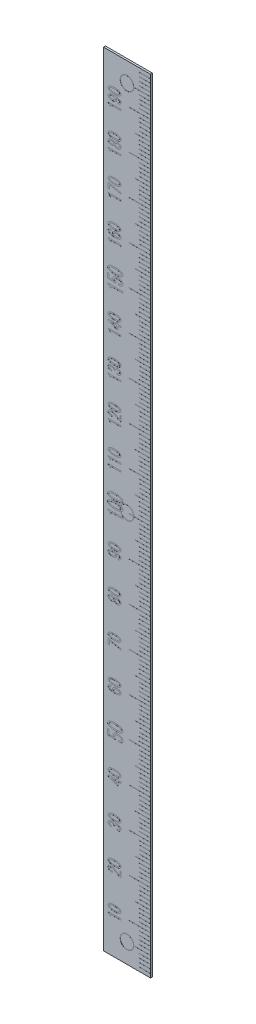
SolidWorks part; units mm, degrees
ref_plane "Front" through (0, 0, 0) normal (0, 0, 1) x (1, 0, 0)
ref_plane "Top" through (0, 0, 0) normal (0, 1, 0) x (1, 0, 0)
ref_plane "Right" through (0, 0, 0) normal (1, 0, 0) x (0, 0, -1)
sketch "Sketch1" plane through (0, 0, 0) normal (0, 0, 1) x (1, 0, 0)
  line L1 (0, 0) -> (0, 200)
  line L2 (0, 0) -> (12, 0)
  line L3 (12, 0) -> (12, 200)
  line L4 (0, 200) -> (12, 200)
  dimension "D1" = 200
  dimension "D2" = 12
extrude "Extrude1" add sketch "Sketch1" along normal blind 0.5
sketch "Sketch2" plane through (0, 0, 0.5) normal (0, 0, 1) x (1, 0, 0)
  line L0 (0, 200) -> (0, 0) construction
  line L1 (0, 0) -> (12, 0) construction
  line L2 (12, 200) -> (0, 200) construction
  circle A0 centre (6, 5) radius 1.75
  circle A1 centre (6, 195) radius 1.75
  circle A2 centre (6, 5) radius 1.65
  circle A3 centre (6, 195) radius 1.65
  circle A4 centre (6, 100) radius 1.75
  circle A5 centre (6, 100) radius 1.65
  dimension "D1" = 6
  dimension "D2" = 6
  dimension "D3" = 5
  dimension "D4" = 5
  dimension "D5" = 3.5
  dimension "D6" = 3.5
  dimension "D7" = 0.1
  dimension "D8" = 2
extrude "Extrude2" cut sketch "Sketch2" against normal blind 0.01
sketch "Sketch3" plane through (0, 0, 0.5) normal (0, 0, 1) x (1, 0, 0)
  line L0 (1, 187.4) -> (4.5, 187.4) construction
  line L1 (1, 137.4) -> (4.5, 137.4) construction
  line L2 (1, 137.4) -> (1, 140.9) construction
  line L3 (1, 140.9) -> (4.5, 140.9) construction
  line L4 (4.5, 137.4) -> (4.5, 140.9) construction
  line L5 (0, 200) -> (0, 0) construction
  line L6 (4.5, 127.4) -> (4.5, 130.9) construction
  line L7 (4.5, 117.4) -> (4.5, 120.9) construction
  line L8 (4.5, 107.4) -> (4.5, 110.9) construction
  line L9 (5, 97.2) -> (5, 102.8) construction
  line L10 (4.5, 88.25) -> (4.5, 91.75) construction
  line L11 (4.5, 78.25) -> (4.5, 81.75) construction
  line L12 (4.5, 68.25) -> (4.5, 71.75) construction
  line L13 (4.5, 58.25) -> (4.5, 61.75) construction
  line L14 (5, 48) -> (5, 52) construction
  line L15 (4.5, 38.25) -> (4.5, 43.5) construction
  line L16 (5, 110) -> (-4.9003, 110) construction
  line L17 (5, 50) -> (-4.9003, 50) construction
  line L18 (4.5, 28.25) -> (4.5, 33.5) construction
  line L19 (4.5, 18.25) -> (4.5, 23.5) construction
  line L20 (4.5, 8.25) -> (4.5, 13.5) construction
  line L21 (5, 100) -> (-4.9003, 100) construction
  line L22 (5, 120) -> (-4.9003, 120) construction
  line L23 (5, 130) -> (-4.9003, 130) construction
  line L24 (5, 140) -> (-4.9003, 140) construction
  line L25 (1, 187.4) -> (1, 190.9) construction
  line L26 (1, 190.9) -> (4.5, 190.9) construction
  line L27 (4.5, 187.4) -> (4.5, 190.9) construction
  line L28 (4.5, 177.4) -> (4.5, 180.9) construction
  line L29 (4.5, 167.4) -> (4.5, 170.9) construction
  line L30 (4.5, 157.4) -> (4.5, 160.9) construction
  line L31 (5, 147.2) -> (5, 152.8) construction
  line L32 (4.5, 160) -> (-4.9003, 160) construction
  line L33 (4.5, 150) -> (-4.9003, 150) construction
  line L34 (4.5, 170) -> (-4.9003, 170) construction
  line L35 (4.5, 180) -> (-4.9003, 180) construction
  line L36 (4.5, 190) -> (-4.9003, 190) construction
  line L37 (5, 40) -> (-4.9003, 40) construction
  line L38 (5, 30) -> (-4.9003, 30) construction
  line L39 (5, 20) -> (-4.9003, 20) construction
  line L40 (5, 10) -> (-4.9003, 10) construction
  line L41 (12, 0) -> (12, 200) construction
  text T0 "140" font "ＭＳ ゴシック" height in points 11
  text T1 "130" font "ＭＳ ゴシック" height in points 11
  text T2 "120" font "ＭＳ ゴシック" height in points 11
  text T3 "110" font "ＭＳ ゴシック" height in points 11
  text T4 "100" font "ＭＳ ゴシック" height in points 13
  text T5 "90" font "ＭＳ ゴシック" height in points 11
  text T6 "80" font "ＭＳ ゴシック" height in points 11
  text T7 "70" font "ＭＳ ゴシック" height in points 11
  text T8 "60" font "ＭＳ ゴシック" height in points 11
  text T9 "50" font "ＭＳ ゴシック" height in points 13
  text T10 "40" font "ＭＳ ゴシック" height in points 11
  text T11 "30" font "ＭＳ ゴシック" height in points 11
  text T12 "20" font "ＭＳ ゴシック" height in points 11
  text T13 "10" font "ＭＳ ゴシック" height in points 11
  text T14 "150" font "ＭＳ ゴシック" height in points 13
  text T15 "160" font "ＭＳ ゴシック" height in points 11
  text T16 "170" font "ＭＳ ゴシック" height in points 11
  text T17 "180" font "ＭＳ ゴシック" height in points 11
  text T18 "190" font "ＭＳ ゴシック" height in points 11
  point P19 (5, 100)
  dimension "D1" = 3.5
  dimension "D2" = 2.6
  dimension "D3" = 1
  dimension "D4" = 3.5
  dimension "D8" = 4
  dimension "D9" = 50
  dimension "D10" = 2
  dimension "D11" = 5.6
  dimension "D12" = 2.6
  dimension "D5" = 3.5
  dimension "D13" = 2.6
  dimension "D14" = 2.6
  dimension "D15" = 7
  dimension "D16" = 1.75
  dimension "D17" = 1.75
  dimension "D18" = 1.75
  dimension "D19" = 1.75
  dimension "D20" = 7
  dimension "D21" = 7
  dimension "D6" = 5
  dimension "D7" = 5
extrude "Extrude3" cut sketch "Sketch3" against normal blind 0.01
sketch "Sketch4" plane through (0, 0, 0.5) normal (0, 0, 1) x (1, 0, 0)
  line L0 (12, 190.05) -> (6.5, 190.05)
  line L1 (12, 0) -> (12, 200) construction
  line L2 (6.5, 190.05) -> (6.5, 189.95)
  line L3 (6.5, 189.95) -> (12, 189.95)
  line L4 (12, 189.95) -> (12, 190.05)
  line L5 (12, 200) -> (0, 200) construction
  line L6 (12, 198.05) -> (12, 197.95)
  line L7 (12, 194.95) -> (8, 194.95)
  line L8 (12, 194.95) -> (12, 195.05)
  line L9 (12, 195.05) -> (8, 195.05)
  line L10 (8, 194.95) -> (8, 195.05)
  line L11 (12, 199.05) -> (9, 199.05)
  line L12 (12, 199.05) -> (12, 198.95)
  line L13 (12, 198.95) -> (9, 198.95)
  line L14 (9, 199.05) -> (9, 198.95)
  line L15 (12, 198.05) -> (9, 198.05)
  line L16 (12, 197.95) -> (9, 197.95)
  line L17 (9, 198.05) -> (9, 197.95)
  line L18 (12, 197.05) -> (12, 196.95)
  line L19 (12, 197.05) -> (9, 197.05)
  line L20 (12, 196.95) -> (9, 196.95)
  line L21 (9, 197.05) -> (9, 196.95)
  line L22 (12, 196.05) -> (12, 195.95)
  line L23 (12, 196.05) -> (9, 196.05)
  line L24 (12, 195.95) -> (9, 195.95)
  line L25 (9, 196.05) -> (9, 195.95)
  line L26 (12, 180.05) -> (6.5, 180.05)
  line L27 (6.5, 180.05) -> (6.5, 179.95)
  line L28 (6.5, 179.95) -> (12, 179.95)
  line L29 (12, 179.95) -> (12, 180.05)
  line L30 (12, 194.05) -> (12, 193.95)
  line L31 (12, 194.05) -> (9, 194.05)
  line L32 (12, 193.95) -> (9, 193.95)
  line L33 (9, 194.05) -> (9, 193.95)
  line L34 (12, 193.05) -> (12, 192.95)
  line L35 (12, 193.05) -> (9, 193.05)
  line L36 (12, 192.95) -> (9, 192.95)
  line L37 (9, 193.05) -> (9, 192.95)
  line L38 (12, 192.05) -> (12, 191.95)
  line L39 (12, 192.05) -> (9, 192.05)
  line L40 (12, 191.95) -> (9, 191.95)
  line L41 (9, 192.05) -> (9, 191.95)
  line L42 (12, 191.05) -> (12, 190.95)
  line L43 (12, 191.05) -> (9, 191.05)
  line L44 (12, 190.95) -> (9, 190.95)
  line L45 (9, 191.05) -> (9, 190.95)
  line L46 (9, 195.05) -> (9, 194.95)
  line L47 (12, 195.05) -> (9, 195.05)
  line L48 (12, 194.95) -> (9, 194.95)
  line L49 (12, 195.05) -> (12, 194.95)
  line L50 (12, 188.05) -> (12, 187.95)
  line L51 (12, 184.95) -> (8, 184.95)
  line L52 (12, 184.95) -> (12, 185.05)
  line L53 (12, 185.05) -> (8, 185.05)
  line L54 (8, 184.95) -> (8, 185.05)
  line L55 (12, 189.05) -> (9, 189.05)
  line L56 (12, 189.05) -> (12, 188.95)
  line L57 (12, 188.95) -> (9, 188.95)
  line L58 (9, 189.05) -> (9, 188.95)
  line L59 (12, 188.05) -> (9, 188.05)
  line L60 (12, 187.95) -> (9, 187.95)
  line L61 (9, 188.05) -> (9, 187.95)
  line L62 (12, 187.05) -> (12, 186.95)
  line L63 (12, 187.05) -> (9, 187.05)
  line L64 (12, 186.95) -> (9, 186.95)
  line L65 (9, 187.05) -> (9, 186.95)
  line L66 (12, 186.05) -> (12, 185.95)
  line L67 (12, 186.05) -> (9, 186.05)
  line L68 (12, 185.95) -> (9, 185.95)
  line L69 (9, 186.05) -> (9, 185.95)
  line L70 (12, 184.05) -> (12, 183.95)
  line L71 (12, 184.05) -> (9, 184.05)
  line L72 (12, 183.95) -> (9, 183.95)
  line L73 (9, 184.05) -> (9, 183.95)
  line L74 (12, 183.05) -> (12, 182.95)
  line L75 (12, 183.05) -> (9, 183.05)
  line L76 (12, 182.95) -> (9, 182.95)
  line L77 (9, 183.05) -> (9, 182.95)
  line L78 (12, 182.05) -> (12, 181.95)
  line L79 (12, 182.05) -> (9, 182.05)
  line L80 (12, 181.95) -> (9, 181.95)
  line L81 (9, 182.05) -> (9, 181.95)
  line L82 (12, 181.05) -> (12, 180.95)
  line L83 (12, 181.05) -> (9, 181.05)
  line L84 (12, 180.95) -> (9, 180.95)
  line L85 (9, 181.05) -> (9, 180.95)
  line L86 (12, 170.05) -> (6.5, 170.05)
  line L87 (6.5, 170.05) -> (6.5, 169.95)
  line L88 (6.5, 169.95) -> (12, 169.95)
  line L89 (12, 169.95) -> (12, 170.05)
  line L90 (12, 178.05) -> (12, 177.95)
  line L91 (12, 174.95) -> (8, 174.95)
  line L92 (12, 174.95) -> (12, 175.05)
  line L93 (12, 175.05) -> (8, 175.05)
  line L94 (8, 174.95) -> (8, 175.05)
  line L95 (12, 179.05) -> (9, 179.05)
  line L96 (12, 179.05) -> (12, 178.95)
  line L97 (12, 178.95) -> (9, 178.95)
  line L98 (9, 179.05) -> (9, 178.95)
  line L99 (12, 178.05) -> (9, 178.05)
  line L100 (12, 177.95) -> (9, 177.95)
  line L101 (9, 178.05) -> (9, 177.95)
  line L102 (12, 177.05) -> (12, 176.95)
  line L103 (12, 177.05) -> (9, 177.05)
  line L104 (12, 176.95) -> (9, 176.95)
  line L105 (9, 177.05) -> (9, 176.95)
  line L106 (12, 176.05) -> (12, 175.95)
  line L107 (12, 176.05) -> (9, 176.05)
  line L108 (12, 175.95) -> (9, 175.95)
  line L109 (9, 176.05) -> (9, 175.95)
  line L110 (12, 174.05) -> (12, 173.95)
  line L111 (12, 174.05) -> (9, 174.05)
  line L112 (12, 173.95) -> (9, 173.95)
  line L113 (9, 174.05) -> (9, 173.95)
  line L114 (12, 173.05) -> (12, 172.95)
  line L115 (12, 173.05) -> (9, 173.05)
  line L116 (12, 172.95) -> (9, 172.95)
  line L117 (9, 173.05) -> (9, 172.95)
  line L118 (12, 172.05) -> (12, 171.95)
  line L119 (12, 172.05) -> (9, 172.05)
  line L120 (12, 171.95) -> (9, 171.95)
  line L121 (9, 172.05) -> (9, 171.95)
  line L122 (12, 171.05) -> (12, 170.95)
  line L123 (12, 171.05) -> (9, 171.05)
  line L124 (12, 170.95) -> (9, 170.95)
  line L125 (9, 171.05) -> (9, 170.95)
  line L126 (12, 160.05) -> (6.5, 160.05)
  line L127 (6.5, 160.05) -> (6.5, 159.95)
  line L128 (6.5, 159.95) -> (12, 159.95)
  line L129 (12, 159.95) -> (12, 160.05)
  line L130 (12, 168.05) -> (12, 167.95)
  line L131 (12, 164.95) -> (8, 164.95)
  line L132 (12, 164.95) -> (12, 165.05)
  line L133 (12, 165.05) -> (8, 165.05)
  line L134 (8, 164.95) -> (8, 165.05)
  line L135 (12, 169.05) -> (9, 169.05)
  line L136 (12, 169.05) -> (12, 168.95)
  line L137 (12, 168.95) -> (9, 168.95)
  line L138 (9, 169.05) -> (9, 168.95)
  line L139 (12, 168.05) -> (9, 168.05)
  line L140 (12, 167.95) -> (9, 167.95)
  line L141 (9, 168.05) -> (9, 167.95)
  line L142 (12, 167.05) -> (12, 166.95)
  line L143 (12, 167.05) -> (9, 167.05)
  line L144 (12, 166.95) -> (9, 166.95)
  line L145 (9, 167.05) -> (9, 166.95)
  line L146 (12, 166.05) -> (12, 165.95)
  line L147 (12, 166.05) -> (9, 166.05)
  line L148 (12, 165.95) -> (9, 165.95)
  line L149 (9, 166.05) -> (9, 165.95)
  line L150 (12, 164.05) -> (12, 163.95)
  line L151 (12, 164.05) -> (9, 164.05)
  line L152 (12, 163.95) -> (9, 163.95)
  line L153 (9, 164.05) -> (9, 163.95)
  line L154 (12, 163.05) -> (12, 162.95)
  line L155 (12, 163.05) -> (9, 163.05)
  line L156 (12, 162.95) -> (9, 162.95)
  line L157 (9, 163.05) -> (9, 162.95)
  line L158 (12, 162.05) -> (12, 161.95)
  line L159 (12, 162.05) -> (9, 162.05)
  line L160 (12, 161.95) -> (9, 161.95)
  line L161 (9, 162.05) -> (9, 161.95)
  line L162 (12, 161.05) -> (12, 160.95)
  line L163 (12, 161.05) -> (9, 161.05)
  line L164 (12, 160.95) -> (9, 160.95)
  line L165 (9, 161.05) -> (9, 160.95)
  line L166 (12, 150.05) -> (6.5, 150.05)
  line L167 (6.5, 150.05) -> (6.5, 149.95)
  line L168 (6.5, 149.95) -> (12, 149.95)
  line L169 (12, 149.95) -> (12, 150.05)
  line L170 (12, 158.05) -> (12, 157.95)
  line L171 (12, 154.95) -> (8, 154.95)
  line L172 (12, 154.95) -> (12, 155.05)
  line L173 (12, 155.05) -> (8, 155.05)
  line L174 (8, 154.95) -> (8, 155.05)
  line L175 (12, 159.05) -> (9, 159.05)
  line L176 (12, 159.05) -> (12, 158.95)
  line L177 (12, 158.95) -> (9, 158.95)
  line L178 (9, 159.05) -> (9, 158.95)
  line L179 (12, 158.05) -> (9, 158.05)
  line L180 (12, 157.95) -> (9, 157.95)
  line L181 (9, 158.05) -> (9, 157.95)
  line L182 (12, 157.05) -> (12, 156.95)
  line L183 (12, 157.05) -> (9, 157.05)
  line L184 (12, 156.95) -> (9, 156.95)
  line L185 (9, 157.05) -> (9, 156.95)
  line L186 (12, 156.05) -> (12, 155.95)
  line L187 (12, 156.05) -> (9, 156.05)
  line L188 (12, 155.95) -> (9, 155.95)
  line L189 (9, 156.05) -> (9, 155.95)
  line L190 (12, 154.05) -> (12, 153.95)
  line L191 (12, 154.05) -> (9, 154.05)
  line L192 (12, 153.95) -> (9, 153.95)
  line L193 (9, 154.05) -> (9, 153.95)
  line L194 (12, 153.05) -> (12, 152.95)
  line L195 (12, 153.05) -> (9, 153.05)
  line L196 (12, 152.95) -> (9, 152.95)
  line L197 (9, 153.05) -> (9, 152.95)
  line L198 (12, 152.05) -> (12, 151.95)
  line L199 (12, 152.05) -> (9, 152.05)
  line L200 (12, 151.95) -> (9, 151.95)
  line L201 (9, 152.05) -> (9, 151.95)
  line L202 (12, 151.05) -> (12, 150.95)
  line L203 (12, 151.05) -> (9, 151.05)
  line L204 (12, 150.95) -> (9, 150.95)
  line L205 (9, 151.05) -> (9, 150.95)
  line L206 (12, 150.05) -> (6.5, 150.05)
  line L207 (6.5, 150.05) -> (6.5, 149.95)
  line L208 (6.5, 149.95) -> (12, 149.95)
  line L209 (12, 149.95) -> (12, 150.05)
  line L210 (12, 148.05) -> (12, 147.95)
  line L211 (12, 144.95) -> (8, 144.95)
  line L212 (12, 144.95) -> (12, 145.05)
  line L213 (12, 145.05) -> (8, 145.05)
  line L214 (8, 144.95) -> (8, 145.05)
  line L215 (12, 149.05) -> (9, 149.05)
  line L216 (12, 149.05) -> (12, 148.95)
  line L217 (12, 148.95) -> (9, 148.95)
  line L218 (9, 149.05) -> (9, 148.95)
  line L219 (12, 148.05) -> (9, 148.05)
  line L220 (12, 147.95) -> (9, 147.95)
  line L221 (9, 148.05) -> (9, 147.95)
  line L222 (12, 147.05) -> (12, 146.95)
  line L223 (12, 147.05) -> (9, 147.05)
  line L224 (12, 146.95) -> (9, 146.95)
  line L225 (9, 147.05) -> (9, 146.95)
  line L226 (12, 146.05) -> (12, 145.95)
  line L227 (12, 146.05) -> (9, 146.05)
  line L228 (12, 145.95) -> (9, 145.95)
  line L229 (9, 146.05) -> (9, 145.95)
  line L230 (12, 144.05) -> (12, 143.95)
  line L231 (12, 144.05) -> (9, 144.05)
  line L232 (12, 143.95) -> (9, 143.95)
  line L233 (9, 144.05) -> (9, 143.95)
  line L234 (12, 143.05) -> (12, 142.95)
  line L235 (12, 143.05) -> (9, 143.05)
  line L236 (12, 142.95) -> (9, 142.95)
  line L237 (9, 143.05) -> (9, 142.95)
  line L238 (12, 142.05) -> (12, 141.95)
  line L239 (12, 142.05) -> (9, 142.05)
  line L240 (12, 141.95) -> (9, 141.95)
  line L241 (9, 142.05) -> (9, 141.95)
  line L242 (12, 141.05) -> (12, 140.95)
  line L243 (12, 141.05) -> (9, 141.05)
  line L244 (12, 140.95) -> (9, 140.95)
  line L245 (9, 141.05) -> (9, 140.95)
  line L246 (12, 140.05) -> (6.5, 140.05)
  line L247 (6.5, 140.05) -> (6.5, 139.95)
  line L248 (6.5, 139.95) -> (12, 139.95)
  line L249 (12, 139.95) -> (12, 140.05)
  line L250 (12, 138.05) -> (12, 137.95)
  line L251 (12, 134.95) -> (8, 134.95)
  line L252 (12, 134.95) -> (12, 135.05)
  line L253 (12, 135.05) -> (8, 135.05)
  line L254 (8, 134.95) -> (8, 135.05)
  line L255 (12, 139.05) -> (9, 139.05)
  line L256 (12, 139.05) -> (12, 138.95)
  line L257 (12, 138.95) -> (9, 138.95)
  line L258 (9, 139.05) -> (9, 138.95)
  line L259 (12, 138.05) -> (9, 138.05)
  line L260 (12, 137.95) -> (9, 137.95)
  line L261 (9, 138.05) -> (9, 137.95)
  line L262 (12, 137.05) -> (12, 136.95)
  line L263 (12, 137.05) -> (9, 137.05)
  line L264 (12, 136.95) -> (9, 136.95)
  line L265 (9, 137.05) -> (9, 136.95)
  line L266 (12, 136.05) -> (12, 135.95)
  line L267 (12, 136.05) -> (9, 136.05)
  line L268 (12, 135.95) -> (9, 135.95)
  line L269 (9, 136.05) -> (9, 135.95)
  line L270 (12, 134.05) -> (12, 133.95)
  line L271 (12, 134.05) -> (9, 134.05)
  line L272 (12, 133.95) -> (9, 133.95)
  line L273 (9, 134.05) -> (9, 133.95)
  line L274 (12, 133.05) -> (12, 132.95)
  line L275 (12, 133.05) -> (9, 133.05)
  line L276 (12, 132.95) -> (9, 132.95)
  line L277 (9, 133.05) -> (9, 132.95)
  line L278 (12, 132.05) -> (12, 131.95)
  line L279 (12, 132.05) -> (9, 132.05)
  line L280 (12, 131.95) -> (9, 131.95)
  line L281 (9, 132.05) -> (9, 131.95)
  line L282 (12, 131.05) -> (12, 130.95)
  line L283 (12, 131.05) -> (9, 131.05)
  line L284 (12, 130.95) -> (9, 130.95)
  line L285 (9, 131.05) -> (9, 130.95)
  line L286 (12, 130.05) -> (6.5, 130.05)
  line L287 (6.5, 130.05) -> (6.5, 129.95)
  line L288 (6.5, 129.95) -> (12, 129.95)
  line L289 (12, 129.95) -> (12, 130.05)
  line L290 (12, 128.05) -> (12, 127.95)
  line L291 (12, 124.95) -> (8, 124.95)
  line L292 (12, 124.95) -> (12, 125.05)
  line L293 (12, 125.05) -> (8, 125.05)
  line L294 (8, 124.95) -> (8, 125.05)
  line L295 (12, 129.05) -> (9, 129.05)
  line L296 (12, 129.05) -> (12, 128.95)
  line L297 (12, 128.95) -> (9, 128.95)
  line L298 (9, 129.05) -> (9, 128.95)
  line L299 (12, 128.05) -> (9, 128.05)
  line L300 (12, 127.95) -> (9, 127.95)
  line L301 (9, 128.05) -> (9, 127.95)
  line L302 (12, 127.05) -> (12, 126.95)
  line L303 (12, 127.05) -> (9, 127.05)
  line L304 (12, 126.95) -> (9, 126.95)
  line L305 (9, 127.05) -> (9, 126.95)
  line L306 (12, 126.05) -> (12, 125.95)
  line L307 (12, 126.05) -> (9, 126.05)
  line L308 (12, 125.95) -> (9, 125.95)
  line L309 (9, 126.05) -> (9, 125.95)
  line L310 (12, 124.05) -> (12, 123.95)
  line L311 (12, 124.05) -> (9, 124.05)
  line L312 (12, 123.95) -> (9, 123.95)
  line L313 (9, 124.05) -> (9, 123.95)
  line L314 (12, 123.05) -> (12, 122.95)
  line L315 (12, 123.05) -> (9, 123.05)
  line L316 (12, 122.95) -> (9, 122.95)
  line L317 (9, 123.05) -> (9, 122.95)
  line L318 (12, 122.05) -> (12, 121.95)
  line L319 (12, 122.05) -> (9, 122.05)
  line L320 (12, 121.95) -> (9, 121.95)
  line L321 (9, 122.05) -> (9, 121.95)
  line L322 (12, 121.05) -> (12, 120.95)
  line L323 (12, 121.05) -> (9, 121.05)
  line L324 (12, 120.95) -> (9, 120.95)
  line L325 (9, 121.05) -> (9, 120.95)
  line L326 (12, 120.05) -> (6.5, 120.05)
  line L327 (6.5, 120.05) -> (6.5, 119.95)
  line L328 (6.5, 119.95) -> (12, 119.95)
  line L329 (12, 119.95) -> (12, 120.05)
  line L330 (12, 118.05) -> (12, 117.95)
  line L331 (12, 114.95) -> (8, 114.95)
  line L332 (12, 114.95) -> (12, 115.05)
  line L333 (12, 115.05) -> (8, 115.05)
  line L334 (8, 114.95) -> (8, 115.05)
  line L335 (12, 119.05) -> (9, 119.05)
  line L336 (12, 119.05) -> (12, 118.95)
  line L337 (12, 118.95) -> (9, 118.95)
  line L338 (9, 119.05) -> (9, 118.95)
  line L339 (12, 118.05) -> (9, 118.05)
  line L340 (12, 117.95) -> (9, 117.95)
  line L341 (9, 118.05) -> (9, 117.95)
  line L342 (12, 117.05) -> (12, 116.95)
  line L343 (12, 117.05) -> (9, 117.05)
  line L344 (12, 116.95) -> (9, 116.95)
  line L345 (9, 117.05) -> (9, 116.95)
  line L346 (12, 116.05) -> (12, 115.95)
  line L347 (12, 116.05) -> (9, 116.05)
  line L348 (12, 115.95) -> (9, 115.95)
  line L349 (9, 116.05) -> (9, 115.95)
  line L350 (12, 114.05) -> (12, 113.95)
  line L351 (12, 114.05) -> (9, 114.05)
  line L352 (12, 113.95) -> (9, 113.95)
  line L353 (9, 114.05) -> (9, 113.95)
  line L354 (12, 113.05) -> (12, 112.95)
  line L355 (12, 113.05) -> (9, 113.05)
  line L356 (12, 112.95) -> (9, 112.95)
  line L357 (9, 113.05) -> (9, 112.95)
  line L358 (12, 112.05) -> (12, 111.95)
  line L359 (12, 112.05) -> (9, 112.05)
  line L360 (12, 111.95) -> (9, 111.95)
  line L361 (9, 112.05) -> (9, 111.95)
  line L362 (12, 111.05) -> (12, 110.95)
  line L363 (12, 111.05) -> (9, 111.05)
  line L364 (12, 110.95) -> (9, 110.95)
  line L365 (9, 111.05) -> (9, 110.95)
  line L366 (12, 110.05) -> (6.5, 110.05)
  line L367 (6.5, 110.05) -> (6.5, 109.95)
  line L368 (6.5, 109.95) -> (12, 109.95)
  line L369 (12, 109.95) -> (12, 110.05)
  line L370 (12, 108.05) -> (12, 107.95)
  line L371 (12, 104.95) -> (8, 104.95)
  line L372 (12, 104.95) -> (12, 105.05)
  line L373 (12, 105.05) -> (8, 105.05)
  line L374 (8, 104.95) -> (8, 105.05)
  line L375 (12, 109.05) -> (9, 109.05)
  line L376 (12, 109.05) -> (12, 108.95)
  line L377 (12, 108.95) -> (9, 108.95)
  line L378 (9, 109.05) -> (9, 108.95)
  line L379 (12, 108.05) -> (9, 108.05)
  line L380 (12, 107.95) -> (9, 107.95)
  line L381 (9, 108.05) -> (9, 107.95)
  line L382 (12, 107.05) -> (12, 106.95)
  line L383 (12, 107.05) -> (9, 107.05)
  line L384 (12, 106.95) -> (9, 106.95)
  line L385 (9, 107.05) -> (9, 106.95)
  line L386 (12, 106.05) -> (12, 105.95)
  line L387 (12, 106.05) -> (9, 106.05)
  line L388 (12, 105.95) -> (9, 105.95)
  line L389 (9, 106.05) -> (9, 105.95)
  line L390 (12, 104.05) -> (12, 103.95)
  line L391 (12, 104.05) -> (9, 104.05)
  line L392 (12, 103.95) -> (9, 103.95)
  line L393 (9, 104.05) -> (9, 103.95)
  line L394 (12, 103.05) -> (12, 102.95)
  line L395 (12, 103.05) -> (9, 103.05)
  line L396 (12, 102.95) -> (9, 102.95)
  line L397 (9, 103.05) -> (9, 102.95)
  line L398 (12, 102.05) -> (12, 101.95)
  line L399 (12, 102.05) -> (9, 102.05)
  line L400 (12, 101.95) -> (9, 101.95)
  line L401 (9, 102.05) -> (9, 101.95)
  line L402 (12, 101.05) -> (12, 100.95)
  line L403 (12, 101.05) -> (9, 101.05)
  line L404 (12, 100.95) -> (9, 100.95)
  line L405 (9, 101.05) -> (9, 100.95)
  line L406 (12, 100.05) -> (6.5, 100.05)
  line L407 (6.5, 100.05) -> (6.5, 99.95)
  line L408 (6.5, 99.95) -> (12, 99.95)
  line L409 (12, 99.95) -> (12, 100.05)
  line L410 (12, 98.05) -> (12, 97.95)
  line L411 (12, 94.95) -> (8, 94.95)
  line L412 (12, 94.95) -> (12, 95.05)
  line L413 (12, 95.05) -> (8, 95.05)
  line L414 (8, 94.95) -> (8, 95.05)
  line L415 (12, 99.05) -> (9, 99.05)
  line L416 (12, 99.05) -> (12, 98.95)
  line L417 (12, 98.95) -> (9, 98.95)
  line L418 (9, 99.05) -> (9, 98.95)
  line L419 (12, 98.05) -> (9, 98.05)
  line L420 (12, 97.95) -> (9, 97.95)
  line L421 (9, 98.05) -> (9, 97.95)
  line L422 (12, 97.05) -> (12, 96.95)
  line L423 (12, 97.05) -> (9, 97.05)
  line L424 (12, 96.95) -> (9, 96.95)
  line L425 (9, 97.05) -> (9, 96.95)
  line L426 (12, 96.05) -> (12, 95.95)
  line L427 (12, 96.05) -> (9, 96.05)
  line L428 (12, 95.95) -> (9, 95.95)
  line L429 (9, 96.05) -> (9, 95.95)
  line L430 (12, 94.05) -> (12, 93.95)
  line L431 (12, 94.05) -> (9, 94.05)
  line L432 (12, 93.95) -> (9, 93.95)
  line L433 (9, 94.05) -> (9, 93.95)
  line L434 (12, 93.05) -> (12, 92.95)
  line L435 (12, 93.05) -> (9, 93.05)
  line L436 (12, 92.95) -> (9, 92.95)
  line L437 (9, 93.05) -> (9, 92.95)
  line L438 (12, 92.05) -> (12, 91.95)
  line L439 (12, 92.05) -> (9, 92.05)
  line L440 (12, 91.95) -> (9, 91.95)
  line L441 (9, 92.05) -> (9, 91.95)
  line L442 (12, 91.05) -> (12, 90.95)
  line L443 (12, 91.05) -> (9, 91.05)
  line L444 (12, 90.95) -> (9, 90.95)
  line L445 (9, 91.05) -> (9, 90.95)
  line L446 (12, 90.05) -> (6.5, 90.05)
  line L447 (6.5, 90.05) -> (6.5, 89.95)
  line L448 (6.5, 89.95) -> (12, 89.95)
  line L449 (12, 89.95) -> (12, 90.05)
  line L450 (12, 88.05) -> (12, 87.95)
  line L451 (12, 84.95) -> (8, 84.95)
  line L452 (12, 84.95) -> (12, 85.05)
  line L453 (12, 85.05) -> (8, 85.05)
  line L454 (8, 84.95) -> (8, 85.05)
  line L455 (12, 89.05) -> (9, 89.05)
  line L456 (12, 89.05) -> (12, 88.95)
  line L457 (12, 88.95) -> (9, 88.95)
  line L458 (9, 89.05) -> (9, 88.95)
  line L459 (12, 88.05) -> (9, 88.05)
  line L460 (12, 87.95) -> (9, 87.95)
  line L461 (9, 88.05) -> (9, 87.95)
  line L462 (12, 87.05) -> (12, 86.95)
  line L463 (12, 87.05) -> (9, 87.05)
  line L464 (12, 86.95) -> (9, 86.95)
  line L465 (9, 87.05) -> (9, 86.95)
  line L466 (12, 86.05) -> (12, 85.95)
  line L467 (12, 86.05) -> (9, 86.05)
  line L468 (12, 85.95) -> (9, 85.95)
  line L469 (9, 86.05) -> (9, 85.95)
  line L470 (12, 84.05) -> (12, 83.95)
  line L471 (12, 84.05) -> (9, 84.05)
  line L472 (12, 83.95) -> (9, 83.95)
  line L473 (9, 84.05) -> (9, 83.95)
  line L474 (12, 83.05) -> (12, 82.95)
  line L475 (12, 83.05) -> (9, 83.05)
  line L476 (12, 82.95) -> (9, 82.95)
  line L477 (9, 83.05) -> (9, 82.95)
  line L478 (12, 82.05) -> (12, 81.95)
  line L479 (12, 82.05) -> (9, 82.05)
  line L480 (12, 81.95) -> (9, 81.95)
  line L481 (9, 82.05) -> (9, 81.95)
  line L482 (12, 81.05) -> (12, 80.95)
  line L483 (12, 81.05) -> (9, 81.05)
  line L484 (12, 80.95) -> (9, 80.95)
  line L485 (9, 81.05) -> (9, 80.95)
  line L486 (12, 80.05) -> (6.5, 80.05)
  line L487 (6.5, 80.05) -> (6.5, 79.95)
  line L488 (6.5, 79.95) -> (12, 79.95)
  line L489 (12, 79.95) -> (12, 80.05)
  line L490 (12, 78.05) -> (12, 77.95)
  line L491 (12, 74.95) -> (8, 74.95)
  line L492 (12, 74.95) -> (12, 75.05)
  line L493 (12, 75.05) -> (8, 75.05)
  line L494 (8, 74.95) -> (8, 75.05)
  line L495 (12, 79.05) -> (9, 79.05)
  line L496 (12, 79.05) -> (12, 78.95)
  line L497 (12, 78.95) -> (9, 78.95)
  line L498 (9, 79.05) -> (9, 78.95)
  line L499 (12, 78.05) -> (9, 78.05)
  line L500 (12, 77.95) -> (9, 77.95)
  line L501 (9, 78.05) -> (9, 77.95)
  line L502 (12, 77.05) -> (12, 76.95)
  line L503 (12, 77.05) -> (9, 77.05)
  line L504 (12, 76.95) -> (9, 76.95)
  line L505 (9, 77.05) -> (9, 76.95)
  line L506 (12, 76.05) -> (12, 75.95)
  line L507 (12, 76.05) -> (9, 76.05)
  line L508 (12, 75.95) -> (9, 75.95)
  line L509 (9, 76.05) -> (9, 75.95)
  line L510 (12, 74.05) -> (12, 73.95)
  line L511 (12, 74.05) -> (9, 74.05)
  line L512 (12, 73.95) -> (9, 73.95)
  line L513 (9, 74.05) -> (9, 73.95)
  line L514 (12, 73.05) -> (12, 72.95)
  line L515 (12, 73.05) -> (9, 73.05)
  line L516 (12, 72.95) -> (9, 72.95)
  line L517 (9, 73.05) -> (9, 72.95)
  line L518 (12, 72.05) -> (12, 71.95)
  line L519 (12, 72.05) -> (9, 72.05)
  line L520 (12, 71.95) -> (9, 71.95)
  line L521 (9, 72.05) -> (9, 71.95)
  line L522 (12, 71.05) -> (12, 70.95)
  line L523 (12, 71.05) -> (9, 71.05)
  line L524 (12, 70.95) -> (9, 70.95)
  line L525 (9, 71.05) -> (9, 70.95)
  line L526 (12, 70.05) -> (6.5, 70.05)
  line L527 (6.5, 70.05) -> (6.5, 69.95)
  line L528 (6.5, 69.95) -> (12, 69.95)
  line L529 (12, 69.95) -> (12, 70.05)
  line L530 (12, 68.05) -> (12, 67.95)
  line L531 (12, 64.95) -> (8, 64.95)
  line L532 (12, 64.95) -> (12, 65.05)
  line L533 (12, 65.05) -> (8, 65.05)
  line L534 (8, 64.95) -> (8, 65.05)
  line L535 (12, 69.05) -> (9, 69.05)
  line L536 (12, 69.05) -> (12, 68.95)
  line L537 (12, 68.95) -> (9, 68.95)
  line L538 (9, 69.05) -> (9, 68.95)
  line L539 (12, 68.05) -> (9, 68.05)
  line L540 (12, 67.95) -> (9, 67.95)
  line L541 (9, 68.05) -> (9, 67.95)
  line L542 (12, 67.05) -> (12, 66.95)
  line L543 (12, 67.05) -> (9, 67.05)
  line L544 (12, 66.95) -> (9, 66.95)
  line L545 (9, 67.05) -> (9, 66.95)
  line L546 (12, 66.05) -> (12, 65.95)
  line L547 (12, 66.05) -> (9, 66.05)
  line L548 (12, 65.95) -> (9, 65.95)
  line L549 (9, 66.05) -> (9, 65.95)
  line L550 (12, 64.05) -> (12, 63.95)
  line L551 (12, 64.05) -> (9, 64.05)
  line L552 (12, 63.95) -> (9, 63.95)
  line L553 (9, 64.05) -> (9, 63.95)
  line L554 (12, 63.05) -> (12, 62.95)
  line L555 (12, 63.05) -> (9, 63.05)
  line L556 (12, 62.95) -> (9, 62.95)
  line L557 (9, 63.05) -> (9, 62.95)
  line L558 (12, 62.05) -> (12, 61.95)
  line L559 (12, 62.05) -> (9, 62.05)
  line L560 (12, 61.95) -> (9, 61.95)
  line L561 (9, 62.05) -> (9, 61.95)
  line L562 (12, 61.05) -> (12, 60.95)
  line L563 (12, 61.05) -> (9, 61.05)
  line L564 (12, 60.95) -> (9, 60.95)
  line L565 (9, 61.05) -> (9, 60.95)
  line L566 (12, 60.05) -> (6.5, 60.05)
  line L567 (6.5, 60.05) -> (6.5, 59.95)
  line L568 (6.5, 59.95) -> (12, 59.95)
  line L569 (12, 59.95) -> (12, 60.05)
  line L570 (12, 58.05) -> (12, 57.95)
  line L571 (12, 54.95) -> (8, 54.95)
  line L572 (12, 54.95) -> (12, 55.05)
  line L573 (12, 55.05) -> (8, 55.05)
  line L574 (8, 54.95) -> (8, 55.05)
  line L575 (12, 59.05) -> (9, 59.05)
  line L576 (12, 59.05) -> (12, 58.95)
  line L577 (12, 58.95) -> (9, 58.95)
  line L578 (9, 59.05) -> (9, 58.95)
  line L579 (12, 58.05) -> (9, 58.05)
  line L580 (12, 57.95) -> (9, 57.95)
  line L581 (9, 58.05) -> (9, 57.95)
  line L582 (12, 57.05) -> (12, 56.95)
  line L583 (12, 57.05) -> (9, 57.05)
  line L584 (12, 56.95) -> (9, 56.95)
  line L585 (9, 57.05) -> (9, 56.95)
  line L586 (12, 56.05) -> (12, 55.95)
  line L587 (12, 56.05) -> (9, 56.05)
  line L588 (12, 55.95) -> (9, 55.95)
  line L589 (9, 56.05) -> (9, 55.95)
  line L590 (12, 54.05) -> (12, 53.95)
  line L591 (12, 54.05) -> (9, 54.05)
  line L592 (12, 53.95) -> (9, 53.95)
  line L593 (9, 54.05) -> (9, 53.95)
  line L594 (12, 53.05) -> (12, 52.95)
  line L595 (12, 53.05) -> (9, 53.05)
  line L596 (12, 52.95) -> (9, 52.95)
  line L597 (9, 53.05) -> (9, 52.95)
  line L598 (12, 52.05) -> (12, 51.95)
  line L599 (12, 52.05) -> (9, 52.05)
  line L600 (12, 51.95) -> (9, 51.95)
  line L601 (9, 52.05) -> (9, 51.95)
  line L602 (12, 51.05) -> (12, 50.95)
  line L603 (12, 51.05) -> (9, 51.05)
  line L604 (12, 50.95) -> (9, 50.95)
  line L605 (9, 51.05) -> (9, 50.95)
  line L606 (12, 50.05) -> (6.5, 50.05)
  line L607 (6.5, 50.05) -> (6.5, 49.95)
  line L608 (6.5, 49.95) -> (12, 49.95)
  line L609 (12, 49.95) -> (12, 50.05)
  line L610 (12, 48.05) -> (12, 47.95)
  line L611 (12, 44.95) -> (8, 44.95)
  line L612 (12, 44.95) -> (12, 45.05)
  line L613 (12, 45.05) -> (8, 45.05)
  line L614 (8, 44.95) -> (8, 45.05)
  line L615 (12, 49.05) -> (9, 49.05)
  line L616 (12, 49.05) -> (12, 48.95)
  line L617 (12, 48.95) -> (9, 48.95)
  line L618 (9, 49.05) -> (9, 48.95)
  line L619 (12, 48.05) -> (9, 48.05)
  line L620 (12, 47.95) -> (9, 47.95)
  line L621 (9, 48.05) -> (9, 47.95)
  line L622 (12, 47.05) -> (12, 46.95)
  line L623 (12, 47.05) -> (9, 47.05)
  line L624 (12, 46.95) -> (9, 46.95)
  line L625 (9, 47.05) -> (9, 46.95)
  line L626 (12, 46.05) -> (12, 45.95)
  line L627 (12, 46.05) -> (9, 46.05)
  line L628 (12, 45.95) -> (9, 45.95)
  line L629 (9, 46.05) -> (9, 45.95)
  line L630 (12, 44.05) -> (12, 43.95)
  line L631 (12, 44.05) -> (9, 44.05)
  line L632 (12, 43.95) -> (9, 43.95)
  line L633 (9, 44.05) -> (9, 43.95)
  line L634 (12, 43.05) -> (12, 42.95)
  line L635 (12, 43.05) -> (9, 43.05)
  line L636 (12, 42.95) -> (9, 42.95)
  line L637 (9, 43.05) -> (9, 42.95)
  line L638 (12, 42.05) -> (12, 41.95)
  line L639 (12, 42.05) -> (9, 42.05)
  line L640 (12, 41.95) -> (9, 41.95)
  line L641 (9, 42.05) -> (9, 41.95)
  line L642 (12, 41.05) -> (12, 40.95)
  line L643 (12, 41.05) -> (9, 41.05)
  line L644 (12, 40.95) -> (9, 40.95)
  line L645 (9, 41.05) -> (9, 40.95)
  line L646 (12, 40.05) -> (6.5, 40.05)
  line L647 (6.5, 40.05) -> (6.5, 39.95)
  line L648 (6.5, 39.95) -> (12, 39.95)
  line L649 (12, 39.95) -> (12, 40.05)
  line L650 (12, 38.05) -> (12, 37.95)
  line L651 (12, 34.95) -> (8, 34.95)
  line L652 (12, 34.95) -> (12, 35.05)
  line L653 (12, 35.05) -> (8, 35.05)
  line L654 (8, 34.95) -> (8, 35.05)
  line L655 (12, 39.05) -> (9, 39.05)
  line L656 (12, 39.05) -> (12, 38.95)
  line L657 (12, 38.95) -> (9, 38.95)
  line L658 (9, 39.05) -> (9, 38.95)
  line L659 (12, 38.05) -> (9, 38.05)
  line L660 (12, 37.95) -> (9, 37.95)
  line L661 (9, 38.05) -> (9, 37.95)
  line L662 (12, 37.05) -> (12, 36.95)
  line L663 (12, 37.05) -> (9, 37.05)
  line L664 (12, 36.95) -> (9, 36.95)
  line L665 (9, 37.05) -> (9, 36.95)
  line L666 (12, 36.05) -> (12, 35.95)
  line L667 (12, 36.05) -> (9, 36.05)
  line L668 (12, 35.95) -> (9, 35.95)
  line L669 (9, 36.05) -> (9, 35.95)
  line L670 (12, 34.05) -> (12, 33.95)
  line L671 (12, 34.05) -> (9, 34.05)
  line L672 (12, 33.95) -> (9, 33.95)
  line L673 (9, 34.05) -> (9, 33.95)
  line L674 (12, 33.05) -> (12, 32.95)
  line L675 (12, 33.05) -> (9, 33.05)
  line L676 (12, 32.95) -> (9, 32.95)
  line L677 (9, 33.05) -> (9, 32.95)
  line L678 (12, 32.05) -> (12, 31.95)
  line L679 (12, 32.05) -> (9, 32.05)
  line L680 (12, 31.95) -> (9, 31.95)
  line L681 (9, 32.05) -> (9, 31.95)
  line L682 (12, 31.05) -> (12, 30.95)
  line L683 (12, 31.05) -> (9, 31.05)
  line L684 (12, 30.95) -> (9, 30.95)
  line L685 (9, 31.05) -> (9, 30.95)
  line L686 (12, 30.05) -> (6.5, 30.05)
  line L687 (6.5, 30.05) -> (6.5, 29.95)
  line L688 (6.5, 29.95) -> (12, 29.95)
  line L689 (12, 29.95) -> (12, 30.05)
  line L690 (12, 28.05) -> (12, 27.95)
  line L691 (12, 24.95) -> (8, 24.95)
  line L692 (12, 24.95) -> (12, 25.05)
  line L693 (12, 25.05) -> (8, 25.05)
  line L694 (8, 24.95) -> (8, 25.05)
  line L695 (12, 29.05) -> (9, 29.05)
  line L696 (12, 29.05) -> (12, 28.95)
  line L697 (12, 28.95) -> (9, 28.95)
  line L698 (9, 29.05) -> (9, 28.95)
  line L699 (12, 28.05) -> (9, 28.05)
  line L700 (12, 27.95) -> (9, 27.95)
  line L701 (9, 28.05) -> (9, 27.95)
  line L702 (12, 27.05) -> (12, 26.95)
  line L703 (12, 27.05) -> (9, 27.05)
  line L704 (12, 26.95) -> (9, 26.95)
  line L705 (9, 27.05) -> (9, 26.95)
  line L706 (12, 26.05) -> (12, 25.95)
  line L707 (12, 26.05) -> (9, 26.05)
  line L708 (12, 25.95) -> (9, 25.95)
  line L709 (9, 26.05) -> (9, 25.95)
  line L710 (12, 24.05) -> (12, 23.95)
  line L711 (12, 24.05) -> (9, 24.05)
  line L712 (12, 23.95) -> (9, 23.95)
  line L713 (9, 24.05) -> (9, 23.95)
  line L714 (12, 23.05) -> (12, 22.95)
  line L715 (12, 23.05) -> (9, 23.05)
  line L716 (12, 22.95) -> (9, 22.95)
  line L717 (9, 23.05) -> (9, 22.95)
  line L718 (12, 22.05) -> (12, 21.95)
  line L719 (12, 22.05) -> (9, 22.05)
  line L720 (12, 21.95) -> (9, 21.95)
  line L721 (9, 22.05) -> (9, 21.95)
  line L722 (12, 21.05) -> (12, 20.95)
  line L723 (12, 21.05) -> (9, 21.05)
  line L724 (12, 20.95) -> (9, 20.95)
  line L725 (9, 21.05) -> (9, 20.95)
  line L726 (12, 20.05) -> (6.5, 20.05)
  line L727 (6.5, 20.05) -> (6.5, 19.95)
  line L728 (6.5, 19.95) -> (12, 19.95)
  line L729 (12, 19.95) -> (12, 20.05)
  line L730 (12, 18.05) -> (12, 17.95)
  line L731 (12, 14.95) -> (8, 14.95)
  line L732 (12, 14.95) -> (12, 15.05)
  line L733 (12, 15.05) -> (8, 15.05)
  line L734 (8, 14.95) -> (8, 15.05)
  line L735 (12, 19.05) -> (9, 19.05)
  line L736 (12, 19.05) -> (12, 18.95)
  line L737 (12, 18.95) -> (9, 18.95)
  line L738 (9, 19.05) -> (9, 18.95)
  line L739 (12, 18.05) -> (9, 18.05)
  line L740 (12, 17.95) -> (9, 17.95)
  line L741 (9, 18.05) -> (9, 17.95)
  line L742 (12, 17.05) -> (12, 16.95)
  line L743 (12, 17.05) -> (9, 17.05)
  line L744 (12, 16.95) -> (9, 16.95)
  line L745 (9, 17.05) -> (9, 16.95)
  line L746 (12, 16.05) -> (12, 15.95)
  line L747 (12, 16.05) -> (9, 16.05)
  line L748 (12, 15.95) -> (9, 15.95)
  line L749 (9, 16.05) -> (9, 15.95)
  line L750 (12, 14.05) -> (12, 13.95)
  line L751 (12, 14.05) -> (9, 14.05)
  line L752 (12, 13.95) -> (9, 13.95)
  line L753 (9, 14.05) -> (9, 13.95)
  line L754 (12, 13.05) -> (12, 12.95)
  line L755 (12, 13.05) -> (9, 13.05)
  line L756 (12, 12.95) -> (9, 12.95)
  line L757 (9, 13.05) -> (9, 12.95)
  line L758 (12, 12.05) -> (12, 11.95)
  line L759 (12, 12.05) -> (9, 12.05)
  line L760 (12, 11.95) -> (9, 11.95)
  line L761 (9, 12.05) -> (9, 11.95)
  line L762 (12, 11.05) -> (12, 10.95)
  line L763 (12, 11.05) -> (9, 11.05)
  line L764 (12, 10.95) -> (9, 10.95)
  line L765 (9, 11.05) -> (9, 10.95)
  line L766 (12, 10.05) -> (6.5, 10.05)
  line L767 (6.5, 10.05) -> (6.5, 9.95)
  line L768 (6.5, 9.95) -> (12, 9.95)
  line L769 (12, 9.95) -> (12, 10.05)
  line L770 (12, 8.05) -> (12, 7.95)
  line L771 (12, 4.95) -> (8, 4.95)
  line L772 (12, 4.95) -> (12, 5.05)
  line L773 (12, 5.05) -> (8, 5.05)
  line L774 (8, 4.95) -> (8, 5.05)
  line L775 (12, 9.05) -> (9, 9.05)
  line L776 (12, 9.05) -> (12, 8.95)
  line L777 (12, 8.95) -> (9, 8.95)
  line L778 (9, 9.05) -> (9, 8.95)
  line L779 (12, 8.05) -> (9, 8.05)
  line L780 (12, 7.95) -> (9, 7.95)
  line L781 (9, 8.05) -> (9, 7.95)
  line L782 (12, 7.05) -> (12, 6.95)
  line L783 (12, 7.05) -> (9, 7.05)
  line L784 (12, 6.95) -> (9, 6.95)
  line L785 (9, 7.05) -> (9, 6.95)
  line L786 (12, 6.05) -> (12, 5.95)
  line L787 (12, 6.05) -> (9, 6.05)
  line L788 (12, 5.95) -> (9, 5.95)
  line L789 (9, 6.05) -> (9, 5.95)
  line L790 (12, 4.05) -> (12, 3.95)
  line L791 (12, 4.05) -> (9, 4.05)
  line L792 (12, 3.95) -> (9, 3.95)
  line L793 (9, 4.05) -> (9, 3.95)
  line L794 (12, 3.05) -> (12, 2.95)
  line L795 (12, 3.05) -> (9, 3.05)
  line L796 (12, 2.95) -> (9, 2.95)
  line L797 (9, 3.05) -> (9, 2.95)
  line L798 (12, 2.05) -> (12, 1.95)
  line L799 (12, 2.05) -> (9, 2.05)
  line L800 (12, 1.95) -> (9, 1.95)
  line L801 (9, 2.05) -> (9, 1.95)
  line L802 (12, 1.05) -> (12, 0.95)
  line L803 (12, 1.05) -> (9, 1.05)
  line L804 (12, 0.95) -> (9, 0.95)
  line L805 (9, 1.05) -> (9, 0.95)
  point P4 (12, 190)
  point P13 (12, 195)
  point P18 (12, 199)
  dimension "D1" = 10
  dimension "D2" = 0.1
  dimension "D3" = 5.5
  dimension "D4" = 5
  dimension "D5" = 0.1
  dimension "D6" = 1
  dimension "D7" = 0.1
  dimension "D8" = 3
  dimension "D9" = 4
  dimension "D10" = 9
  dimension "D11" = 5
  dimension "D12" = 6
  dimension "D13" = 6
  dimension "D14" = 2
extrude "Extrude4" cut sketch "Sketch4" against normal blind 0.01
move or copy body "Body-Move/Copy2" bodies to move or copy 105 copy no translate (-12, 0, 0)
